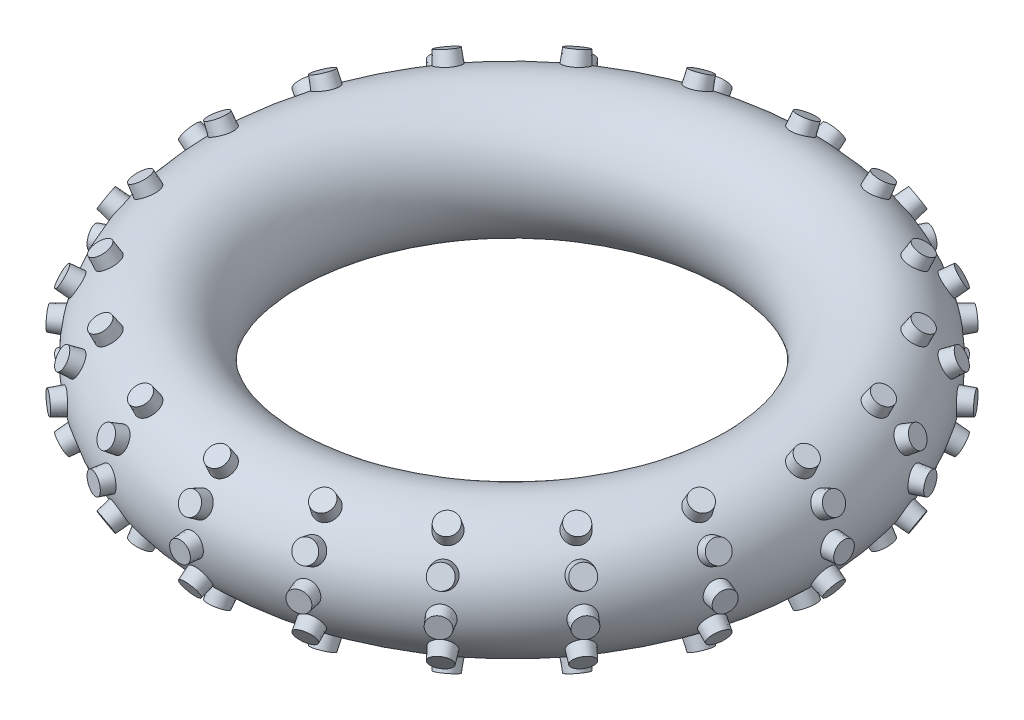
SolidWorks part; units mm, degrees
ref_plane "Ebene vorne" through (0, 0, 0) normal (0, 0, 1) x (1, 0, 0)
ref_plane "Ebene oben" through (0, 0, 0) normal (0, 1, 0) x (1, 0, 0)
ref_plane "Ebene rechts" through (0, 0, 0) normal (1, 0, 0) x (0, 0, -1)
sketch "Skizze1" plane through (0, 0, 0) normal (0, 0, 1) x (1, 0, 0)
  line L1 (-32.9849, 15.5687) -> (-32.9849, -9.8383) construction
  line L2 (8.0151, 0) -> (-8.0151, 0)
  line L3 (0, 0) -> (0, 7.5151) construction
  line L4 (3.7575, 6.5083) -> (0, 0) construction
  line L5 (0, 0) -> (6.5083, 3.7575) construction
  arc A0 (8.0151, 0) -> (-8.0151, 0) centre (0, 0) ccw
  arc A1 (7.5151, 0) -> (0, 7.5151) centre (0, 0) ccw construction
  dimension "D1" = 41
  dimension "D2" = 0.5
  dimension "D3" = 8.0151
  dimension "D4" = 30
  dimension "D5" = 30
revolve "Rotation5" add sketch "Skizze1" angle 360 about L1
ref_plane "Ebene1" through (7.5151, 0, 0) normal (1, 0, 0) x (0, 0, -1)
ref_plane "Ebene2" through (6.5083, 3.7575, 0) normal (0.866, 0.5, 0) x (0, 0, -1)
ref_plane "Ebene3" through (3.7575, 6.5083, 0) normal (-0.5, -0.866, 0) x (0.866, -0.5, 0)
sketch "Skizze2" plane through (7.5151, 0, 0) normal (1, 0, 0) x (0, 0, -1)
  circle A0 centre (0, 0) radius 1.5
  dimension "D1" = 3
extrude "Linear austragen1" add sketch "Skizze2" along normal blind 2 draft 5
sketch "Skizze3" plane through (6.5083, 3.7575, 0) normal (0.866, 0.5, 0) x (0, 0, -1)
  circle A0 centre (0, 0) radius 1.5
  dimension "D1" = 3
extrude "Linear austragen2" add sketch "Skizze3" along normal blind 2 draft 5
sketch "Skizze4" plane through (3.7575, 6.5083, 0) normal (-0.5, -0.866, 0) x (0.866, -0.5, 0)
  circle A0 centre (0, 0) radius 1.5
  dimension "D1" = 3
extrude "Linear austragen3" add sketch "Skizze4" against normal blind 2 draft 5
pattern_circular "Kreismuster1" count 20 over 360 about axis through (-32.9849, 0, 0) along (0, 1, 0) of "Linear austragen1", "Linear austragen2", "Linear austragen3"
mirror "Spiegeln1" about plane through (8.0151, 0, 0) normal (0, 1, 0)
